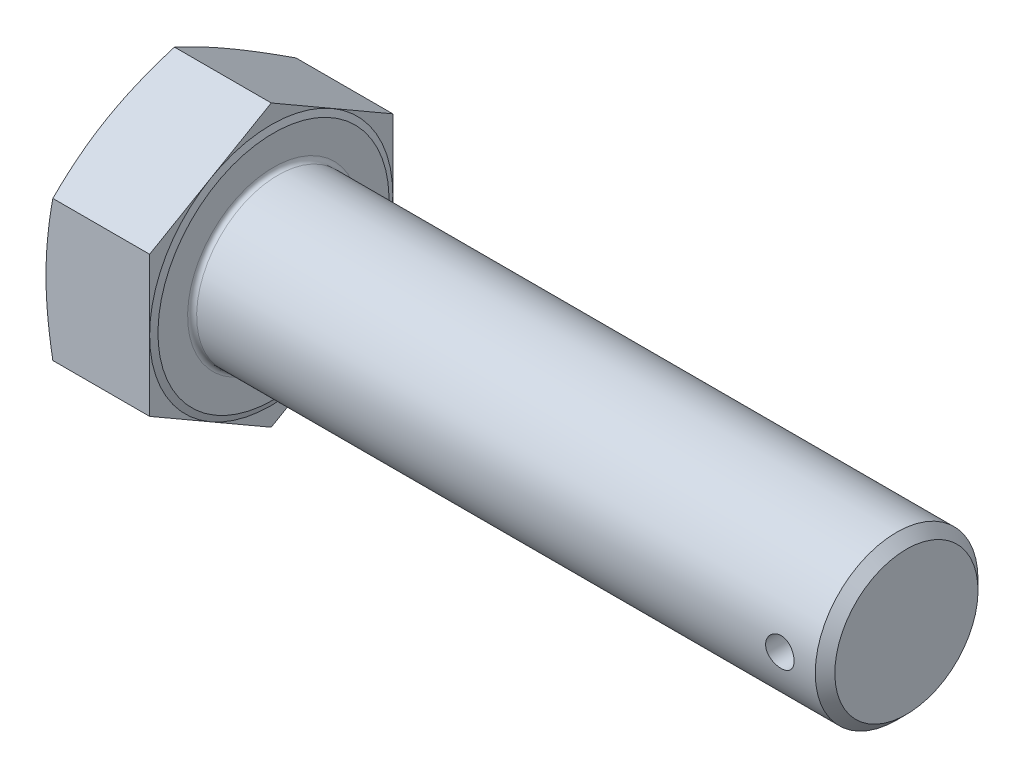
SolidWorks part; units mm, degrees
ref_plane "Front" through (0, 0, 0) normal (0, 0, 1) x (1, 0, 0)
ref_plane "Top" through (0, 0, 0) normal (0, 1, 0) x (1, 0, 0)
ref_plane "Right" through (0, 0, 0) normal (1, 0, 0) x (0, 0, -1)
sketch "Sketch-BaseHead" plane through (0, 0, 0) normal (1, 0, 0) x (0, 0, -1)
  line L1 (0, -31.0614) -> (26.9, -15.5307)
  line L2 (26.9, -15.5307) -> (26.9, 15.5307)
  line L3 (26.9, 15.5307) -> (0, 31.0614)
  line L4 (0, 31.0614) -> (-26.9, 15.5307)
  line L5 (-26.9, 15.5307) -> (-26.9, -15.5307)
  line L6 (-26.9, -15.5307) -> (0, -31.0614)
  circle A0 centre (0, 0) radius 26.9 construction
  dimension "s" = 53.8
extrude "BaseHead" add sketch "Sketch-BaseHead" along normal blind 22.92
sketch "Sketch4" plane through (-0.2646, -5.9169, 0) normal (0, 0, 1) x (0, 1, 0)
  line L0 (5.9169, 3.7369) -> (5.9169, -10.4477) construction
  line L2 (36.9783, -0.2646) -> (32.8169, -0.2646)
  line L4 (32.8169, -0.2646) -> (36.9783, -1.7793)
  line L6 (36.9783, -1.7793) -> (36.9783, -0.2646)
  dimension "D1" = 20
  dimension "D2" = 53.8
revolve "HeadChamfer" cut sketch "Sketch4" angle 360 about L0
sketch "Sketch1" plane through (0, 0, 0) normal (0, 1, 0) x (1, 0, 0)
  line L0 (22.92, 0) -> (23.42, 0)
  line L1 (23.42, 0) -> (23.42, 25.555)
  line L2 (23.42, 25.555) -> (22.92, 26.9)
  line L3 (22.92, 26.9) -> (22.92, 0)
  line L6 (-4.0016, 0) -> (10.1831, 0) construction
  dimension "D1" = 26.9
  dimension "D2" = 25.555
  dimension "D3" = 0.5
revolve "Revolve1" add sketch "Sketch1" angle 360 about axis through (-4.0016, 0, 0) along (1, 0, 0)
ref_plane "Plane2" through (79.42, 0, 0) normal (1, 0, 0) x (0, 0, -1)
sketch "Sketch3" plane through (23.42, 0, 0) normal (1, 0, 0) x (0, 0, -1)
  circle A0 centre (0, 0) radius 18
  dimension "d" = 36
extrude "BaseBody" add sketch "Sketch3" along normal blind 140
chamfer "Chamfer1" distance 2.165 angle 45 1 edges at (163.42, 18, 0)
fillet "HeadFillet" radius 1 1 edges at (23.42, -18, 0)
sketch "Sketch5" plane through (0, 0, 0) normal (0, 0, 1) x (1, 0, 0)
  line L2 (23.42, -25.555) -> (23.42, 25.555) construction
  line L3 (161.255, 0) -> (24.42, 0) construction
  circle A0 centre (153.42, 0) radius 3.15
  dimension "d1" = 6.3
  dimension "lh" = 130
extrude "Hole" cut sketch "Sketch5" against normal through all and the other way through all
equation "\"D1@Sketch1\" = \"s@Sketch-BaseHead\" / 2"
equation "\"D2@Sketch4\" = \"s@Sketch-BaseHead\""
equation "\"D1@Chamfer1\" = (  \"d@Sketch3\"  -\"D2@ThreadCosmetic1\" ) / 2 "
equation "\"b@ThreadCosmetic1\" = \"l@BaseBody\" - \"lg@Plane2\""
